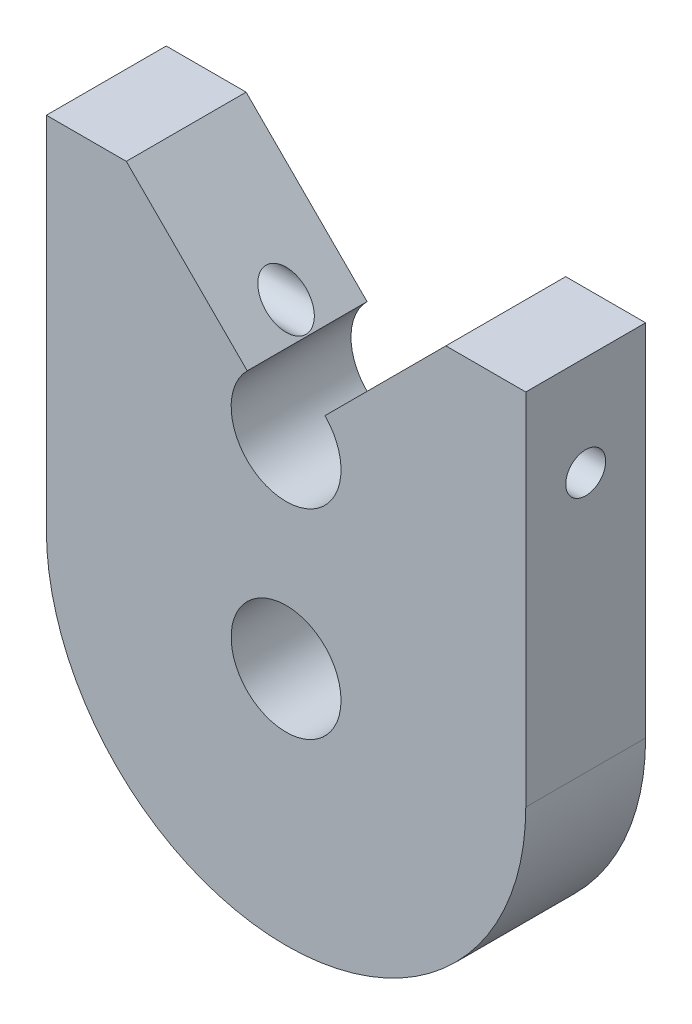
SolidWorks part; units mm, degrees
ref_plane "Front Plane" through (0, 0, 0) normal (0, 0, 1) x (1, 0, 0)
ref_plane "Top Plane" through (0, 0, 0) normal (0, 1, 0) x (1, 0, 0)
ref_plane "Right Plane" through (0, 0, 0) normal (1, 0, 0) x (0, 0, -1)
sketch "Sketch2" plane through (0, 0, 0) normal (0, 0, 1) x (1, 0, 0)
  line L0 (12, 0) -> (12, 18)
  line L1 (12, 18) -> (8, 18)
  line L2 (0, 0) -> (0, 10) construction
  line L3 (1.9445, 11.9445) -> (8, 18)
  line L4 (-12, 0) -> (-12, 18)
  line L5 (-12, 18) -> (-8, 18)
  line L6 (-1.9445, 11.9445) -> (-8, 18)
  line L7 (0, 10) -> (0, 32.9837) construction
  circle A0 centre (0, 0) radius 2.75
  arc A1 (-1.9445, 11.9445) -> (1.9445, 11.9445) centre (0, 10) ccw
  arc A3 (-12, 0) -> (12, 0) centre (0, 0) ccw
  dimension "D1" = 5.5
  dimension "D2" = 12
  dimension "D3" = 5.5
  dimension "D4" = 10
  dimension "D5" = 90
  dimension "D6" = 45
  dimension "D7" = 8
  dimension "D8" = 8
extrude "Extrude1" add sketch "Sketch2" along normal blind 6
sketch "Sketch3" plane through (12, 0, 0) normal (1, 0, 0) x (0, 0, -1)
  line L0 (-6, 0) -> (-6, 18) construction
  line L1 (-6, 18) -> (0, 18) construction
  circle A0 centre (-3, 13) radius 1
  dimension "D1" = 3
  dimension "D2" = 5
  dimension "D3" = 2
extrude "Extrude2" cut sketch "Sketch3" against normal through all
